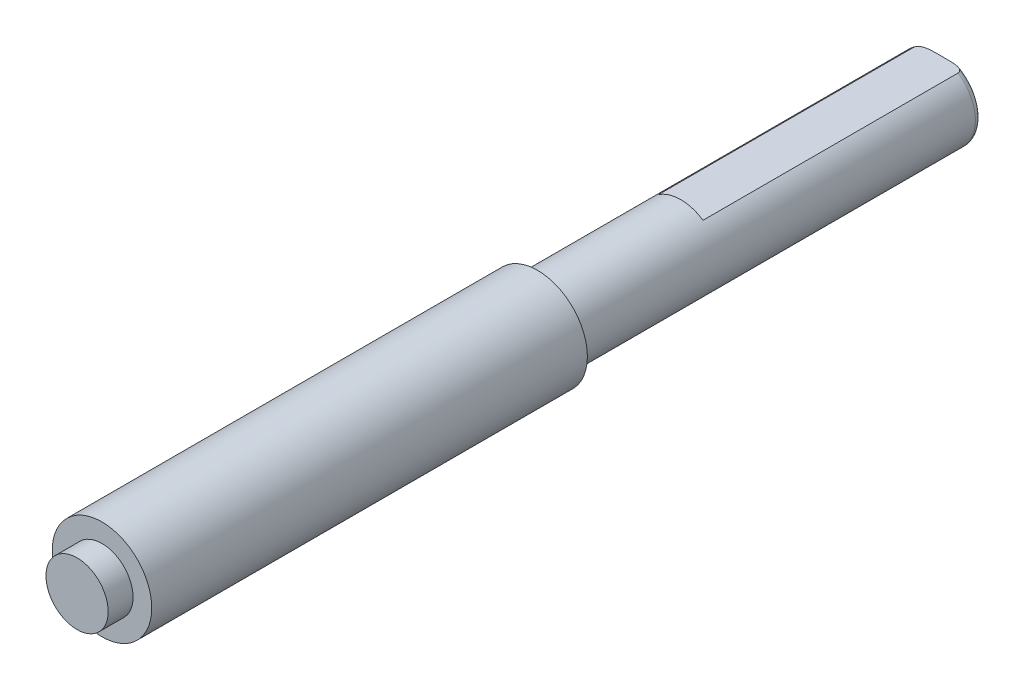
SolidWorks part; units mm, degrees
ref_plane "前视" through (0, 0, 0) normal (0, 0, 1) x (1, 0, 0)
ref_plane "上视" through (0, 0, 0) normal (0, 1, 0) x (1, 0, 0)
ref_plane "右视" through (0, 0, 0) normal (1, 0, 0) x (0, 0, -1)
sketch "草图2" plane through (0, 0, 0) normal (0, 0, 1) x (1, 0, 0)
  circle A0 centre (0, 0) radius 3.175
extrude "凸台-拉伸1" add sketch "草图2" along normal blind 32.5
sketch "草图3" plane through (0, 0, 32.5) normal (0, 0, 1) x (1, 0, 0)
  circle A0 centre (0, 0) radius 4
extrude "凸台-拉伸2" add sketch "草图3" along normal blind 35
sketch "草图4" plane through (0, 0, 0) normal (0, 0, -1) x (-1, 0, 0)
  line L0 (-1.7861, 2.625) -> (1.7861, 2.625)
  arc A0 (1.7861, 2.625) -> (-1.7861, 2.625) centre (0, 0) ccw
extrude "切除-拉伸1" cut sketch "草图4" against normal blind 21
fillet "圆角1" radius 0.5 1 edges at (0, -3.175, 0)
sketch "草图5" plane through (0, 0, 67.5) normal (0, 0, 1) x (1, 0, 0)
  circle A0 centre (0, 0) radius 2.5
extrude "凸台-拉伸3" add sketch "草图5" along normal blind 2
